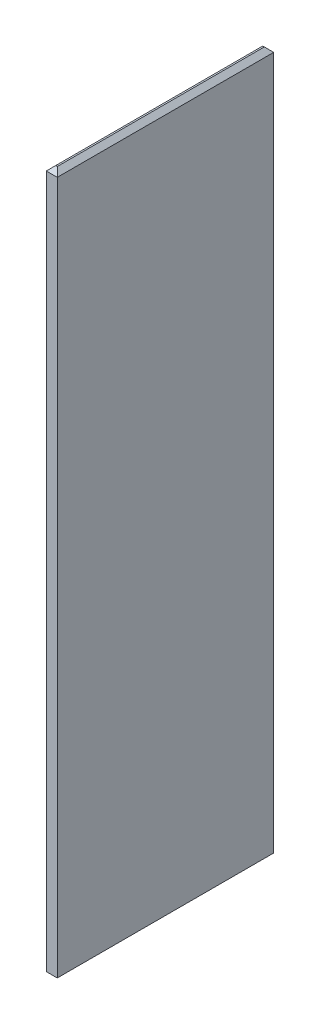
SolidWorks part; units mm, degrees
ref_plane "Front Plane" through (0, 0, 0) normal (1, 0, 0) x (0, 1, 0)
ref_plane "Top Plane" through (0, 0, 0) normal (0, 0, 1) x (0, 1, 0)
ref_plane "Right Plane" through (0, 0, 0) normal (0, 1, 0) x (-1, 0, 0)
sketch "Sketch1" plane through (0, 0, 0) normal (0, 1, 0) x (-1, 0, 0)
  line L1 (-76.2, 1500) -> (76.2, 1500)
  line L2 (-76.2, 1500) -> (-76.2, -1500)
  line L3 (-76.2, -1500) -> (76.2, -1500)
  line L4 (76.2, 1500) -> (76.2, -1500)
  line L5 (-76.2, 1500) -> (76.2, -1500) construction
  line L6 (-76.2, -1500) -> (76.2, 1500) construction
  point P0 (0, 0)
  dimension "D1" = 3000
  dimension "D2" = 152.4
extrude "Boss-Extrude1" add sketch "Sketch1" along normal blind 9739.6
ref_plane "Mating plane" through (0, 0, -1750) normal (0, 0, -1) x (0, 1, 0)
chamfer "Chamfer1" distance 65 angle 45 8 edges at (0, 0, 1500) (76.2, 0, 0) (0, 0, -1500) (-76.2, 0, 0) (0, 9739.6, -1500) (76.2, 9739.6, 0) (0, 9739.6, 1500) (-76.2, 9739.6, 0)
